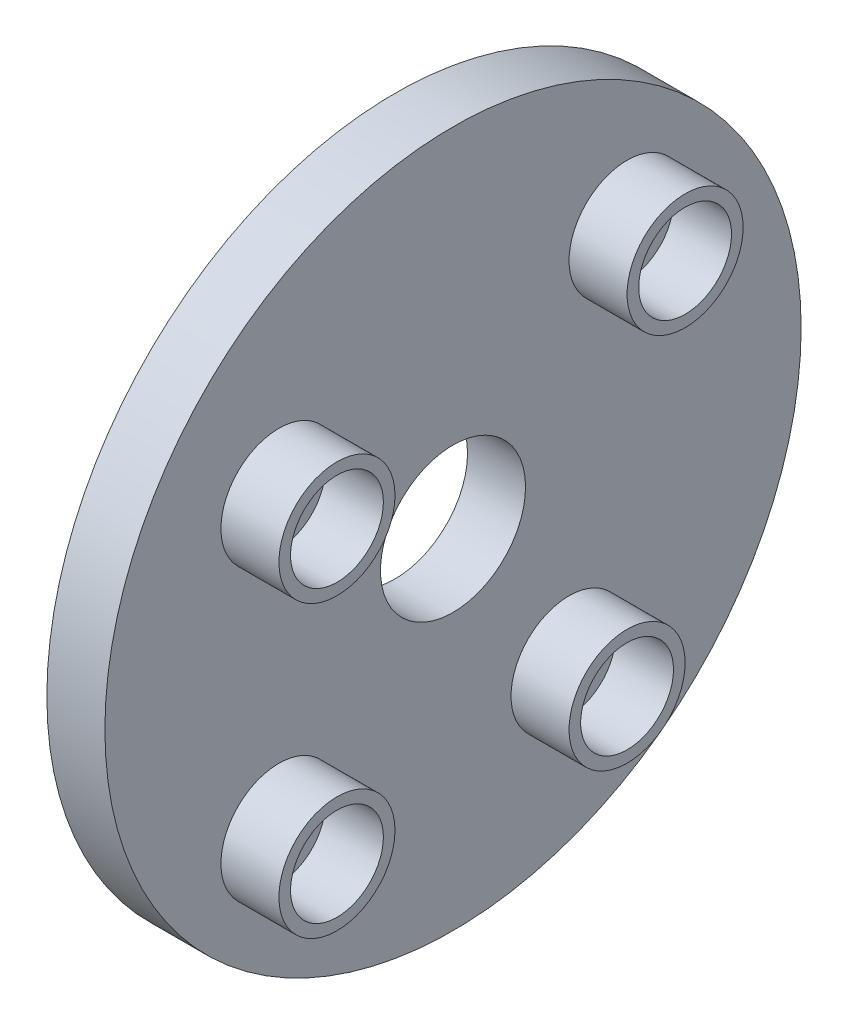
SolidWorks part; units mm, degrees
ref_plane "Front Plane" through (0, 0, 0) normal (0, 0, 1) x (1, 0, 0)
ref_plane "Top Plane" through (0, 0, 0) normal (0, 1, 0) x (1, 0, 0)
ref_plane "Right Plane" through (0, 0, 0) normal (1, 0, 0) x (0, 0, -1)
sketch "Sketch1" plane through (0, 0, 0) normal (1, 0, 0) x (0, 0, -1)
  line L1 (-30, 20) -> (-30, -30) construction
  line L2 (-30, -30) -> (20, -30) construction
  line L3 (0, 70) -> (0, -30) construction
  line L5 (20, -30) -> (-30, 20) construction
  line L6 (-30, -30) -> (0, 0) construction
  circle A0 centre (-30, -30) radius 10
  circle A1 centre (20, -30) radius 10
  circle A2 centre (30, 30) radius 10
  circle A3 centre (-30, 20) radius 10
  circle A4 centre (30, 30) radius 8
  circle A5 centre (-30, 20) radius 8
  circle A6 centre (-30, -30) radius 8
  circle A7 centre (20, -30) radius 8
  dimension "D1" = 20
  dimension "D3" = 30
  dimension "D7" = 20
  dimension "D9" = 50
  dimension "D2" = 50
  dimension "D4" = 60
  dimension "D5" = 20
  dimension "D6" = 2
  dimension "D8" = 60
extrude "Extrude1" add sketch "Sketch1" along normal blind 10
sketch "Sketch3" plane through (0, 0, 0) normal (1, 0, 0) x (0, 0, -1)
  circle A0 centre (0, 0) radius 60
  circle A1 centre (0, 0) radius 12.5
  dimension "D1" = 120
  dimension "D2" = 25
extrude "Extrude2" add sketch "Sketch3" against normal blind 10
